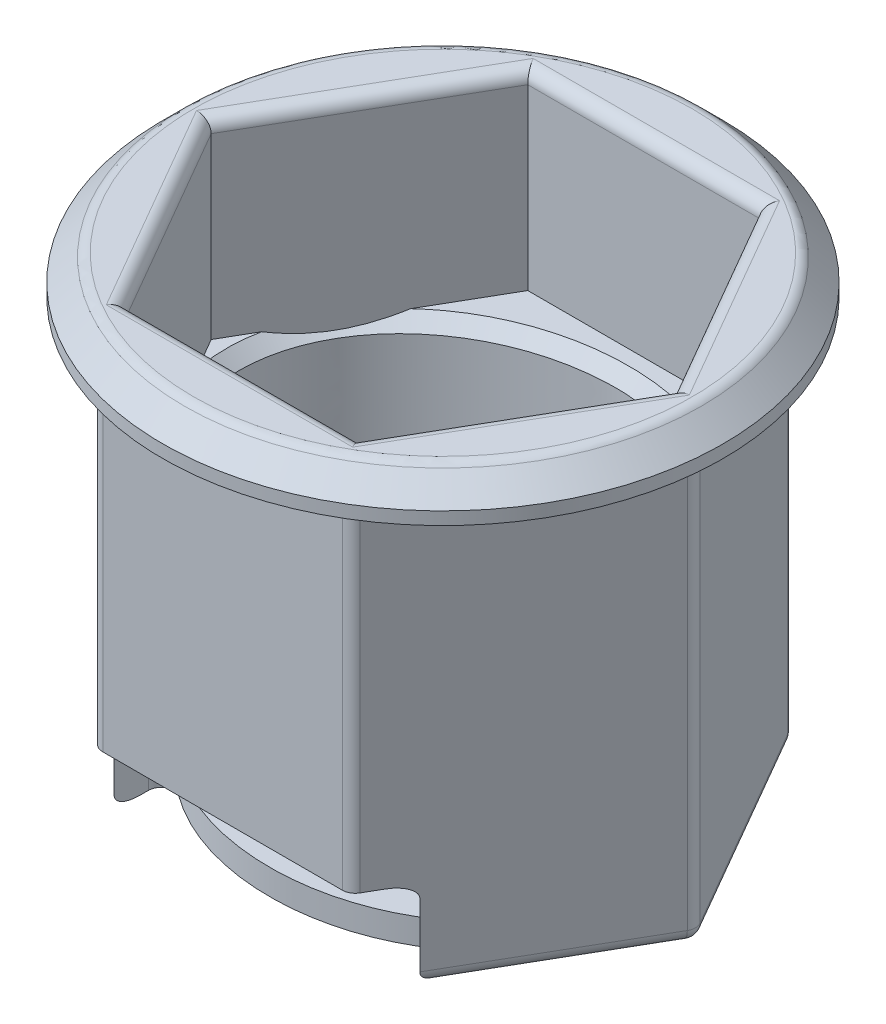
SolidWorks part; units mm, degrees
ref_plane "Front Plane" through (0, 0, 0) normal (0, 0, 1) x (1, 0, 0)
ref_plane "Top Plane" through (0, 0, 0) normal (0, 1, 0) x (1, 0, 0)
ref_plane "Right Plane" through (0, 0, 0) normal (1, 0, 0) x (0, 0, -1)
sketch "Sketch2" plane through (0, 0, 0) normal (0, 1, 0) x (1, 0, 0)
  line L0 (-6.3425, 10.9855) -> (-12.685, 0)
  line L1 (11.5851, 0) -> (5.7926, 10.033) construction
  line L2 (5.7926, 10.033) -> (-5.7926, 10.033) construction
  line L3 (-5.7926, 10.033) -> (-11.5851, 0) construction
  line L4 (-11.5851, 0) -> (-5.7926, -10.033) construction
  line L5 (-5.7926, -10.033) -> (5.7926, -10.033) construction
  line L6 (5.7926, -10.033) -> (11.5851, 0) construction
  line L7 (-12.685, 0) -> (-6.3425, -10.9855)
  line L8 (-6.3425, -10.9855) -> (6.3425, -10.9855)
  line L9 (6.3425, -10.9855) -> (12.685, 0)
  line L10 (12.685, 0) -> (6.3425, 10.9855)
  line L11 (6.3425, 10.9855) -> (-6.3425, 10.9855)
  line L12 (-5.7779, 10.0076) -> (-11.5558, 0)
  line L13 (-11.5558, 0) -> (-5.7779, -10.0076)
  line L14 (-5.7779, -10.0076) -> (5.7779, -10.0076)
  line L15 (5.7779, -10.0076) -> (11.5558, 0)
  line L16 (11.5558, 0) -> (5.7779, 10.0076)
  line L17 (5.7779, 10.0076) -> (-5.7779, 10.0076)
  circle A0 centre (0, 0) radius 10.033 construction
  dimension "D1" = 20.066
  dimension "D2" = 0.9525
  dimension "D3" = 0.0254
extrude "Boss-Extrude1" add sketch "Sketch2" along normal blind 21.59
sketch "Sketch3" plane through (0, 0, 0) normal (0, 1, 0) x (1, 0, 0)
  line L0 (-5.7779, -10.0076) -> (5.7779, -10.0076) construction
  line L1 (5.7779, -10.0076) -> (11.5558, 0) construction
  line L2 (11.5558, 0) -> (5.7779, 10.0076) construction
  line L3 (5.7779, 10.0076) -> (-5.7779, 10.0076) construction
  line L4 (-11.5558, 0) -> (-5.7779, -10.0076) construction
  line L5 (-5.7779, 10.0076) -> (-11.5558, 0) construction
  line L6 (-5.7779, -10.0076) -> (5.7779, -10.0076)
  line L7 (5.7779, -10.0076) -> (11.5558, 0)
  line L8 (11.5558, 0) -> (5.7779, 10.0076)
  line L9 (5.7779, 10.0076) -> (-5.7779, 10.0076)
  line L10 (-11.5558, 0) -> (-5.7779, -10.0076)
  line L11 (-5.7779, 10.0076) -> (-11.5558, 0)
extrude "Boss-Extrude2" add sketch "Sketch3" along normal blind 1.27
sketch "Sketch4" plane through (0, 1.27, 0) normal (0, 1, 0) x (1, 0, 0)
  line L0 (-5.7779, 10.0076) -> (-11.5558, 0) construction
  line L1 (5.7779, 10.0076) -> (-5.7779, 10.0076) construction
  line L2 (11.5558, 0) -> (5.7779, 10.0076) construction
  line L3 (5.7779, -10.0076) -> (11.5558, 0) construction
  line L4 (-5.7779, -10.0076) -> (5.7779, -10.0076) construction
  line L5 (-11.5558, 0) -> (-5.7779, -10.0076) construction
  line L6 (-5.7779, 10.0076) -> (-11.5558, 0)
  line L7 (5.7779, 10.0076) -> (-5.7779, 10.0076)
  line L8 (11.5558, 0) -> (5.7779, 10.0076)
  line L9 (5.7779, -10.0076) -> (11.5558, 0)
  line L10 (-5.7779, -10.0076) -> (5.7779, -10.0076)
  line L11 (-11.5558, 0) -> (-5.7779, -10.0076)
  ellipse E0 centre (0, 0) end of major axis (10.16, 0) minor radius 8.636
  dimension "D1" = 17.272
  dimension "D2" = 20.32
extrude "Boss-Extrude3" add sketch "Sketch4" along normal blind 12.7
sketch "Sketch10" plane through (0, 13.97, 0) normal (0, 1, 0) x (1, 0, 0)
  line L1 (-5.3975, -6.985) -> (5.3975, -6.985)
  line L2 (-5.3975, -6.985) -> (-5.3975, -9.017)
  line L3 (-5.3975, -9.017) -> (5.3975, -9.017)
  line L4 (5.3975, -6.985) -> (5.3975, -9.017)
  point P4 (0, -6.985)
  dimension "D1" = 2.032
  dimension "D2" = 10.795
  dimension "D3" = 6.985
extrude "Cut-Extrude4" cut sketch "Sketch10" against normal up to surface (12.7 mm away)
chamfer "Chamfer1" distance 0.635 angle 45 1 edges at (0, 13.97, -8.636)
sketch "Sketch6" plane through (0, 21.59, 0) normal (0, 1, 0) x (1, 0, 0)
  line L1 (-11.5558, 0) -> (-5.7779, -10.0076)
  line L2 (-5.7779, -10.0076) -> (5.7779, -10.0076)
  line L3 (5.7779, -10.0076) -> (11.5558, 0)
  line L4 (11.5558, 0) -> (5.7779, 10.0076)
  line L5 (5.7779, 10.0076) -> (-5.7779, 10.0076)
  line L6 (-5.7779, 10.0076) -> (-11.5558, 0)
  circle A0 centre (0, 0) radius 10.0076 construction
  circle A1 centre (0, 0) radius 13.97
  dimension "D2" = 27.94
  dimension "D1" = 20.0152
extrude "Boss-Extrude4" add sketch "Sketch6" along normal blind 1.905
chamfer "Chamfer2" distance 1.27 angle 45 1 edges at (0, 23.495, 13.97)
fillet "Fillet1" radius 0.635 7 edges at (0, 23.495, 10.0076) (8.6668, 23.495, 5.0038) (8.6668, 23.495, -5.0038) (0, 23.495, -10.0076) (-8.6668, 23.495, -5.0038) (-8.6668, 23.495, 5.0038) (0, 23.495, 12.7)
sketch "Sketch7" plane through (0, 0, 0) normal (0, -1, 0) x (1, 0, 0)
  circle A0 centre (0, 0) radius 5.2387
  dimension "D1" = 10.4775
extrude "Cut-Extrude2" cut sketch "Sketch7" against normal through all both and the other way through all contours A0
fillet "Fillet2" radius 0.635 18 edges at (-9.5137, 21.59, 5.4928) (-9.5137, 21.59, -5.4928) (-12.685, 10.795, 0) (0, 21.59, -10.9855) (-6.3425, 10.795, -10.9855) (9.5137, 21.59, -5.4928) (6.3425, 10.795, -10.9855) (9.5137, 21.59, 5.4927) (12.685, 10.795, 0) (0, 21.59, 10.9855) (6.3425, 10.795, 10.9855) (-6.3425, 10.795, 10.9855) (-9.5137, 0, 5.4928) (-9.5137, 0, -5.4928) (0, 0, -10.9855) (9.5137, 0, -5.4928) (9.5137, 0, 5.4927) (0, 0, 10.9855)
sketch "Sketch8" plane through (0, 0, 10.9855) normal (0, 0, 1) x (1, 0, 0)
  line L1 (-7.62, 0) -> (7.62, 0)
  line L2 (-7.62, 0) -> (-7.62, 4.445)
  line L3 (-7.62, 4.445) -> (7.62, 4.445)
  line L4 (7.62, 0) -> (7.62, 4.445)
  point P4 (0, 0)
  dimension "D1" = 4.445
  dimension "D2" = 15.24
extrude "Cut-Extrude3" cut sketch "Sketch8" against normal up to surface (5.2733 mm away)
fillet "Fillet4" radius 0.635 4 edges at (-7.62, 0.635, 5.7122) (7.62, 0.635, 5.7122) (7.62, 4.445, 7.2425) (-7.62, 4.445, 7.2425)
